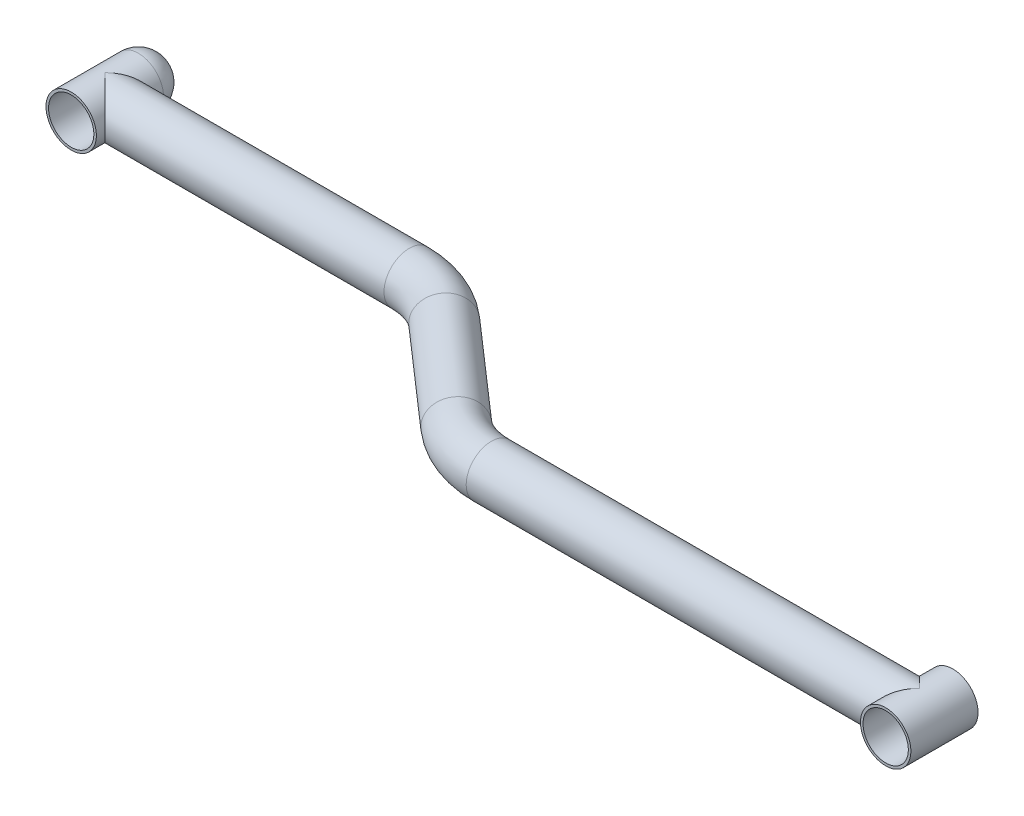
SolidWorks part; units mm, degrees
ref_plane "Plan de face" through (0, 0, 0) normal (0, 0, 1) x (1, 0, 0)
ref_plane "Plan de dessus" through (0, 0, 0) normal (0, 1, 0) x (1, 0, 0)
ref_plane "Plan de droite" through (0, 0, 0) normal (1, 0, 0) x (0, 0, -1)
sketch "Esquisse1" plane through (0, 0, 0) normal (0, 1, 0) x (1, 0, 0)
  line L0 (0, 0) -> (-509.594, 0)
  line L1 (-757.4787, 150) -> (-1120, 150)
  line L2 (-690.6009, 124.8881) -> (-576.4718, 25.1119)
  arc A0 (-757.4787, 150) -> (-690.6009, 124.8881) centre (-757.4787, 48.3898) cw
  arc A1 (-576.4718, 25.1119) -> (-509.594, 0) centre (-509.594, 101.6102) ccw
  dimension "D1" = 1120
  dimension "D2" = 150
sketch "Esquisse2" plane through (0, 0, 0) normal (1, 0, 0) x (0, 0, -1)
  circle A0 centre (0, 0) radius 30
  circle A1 centre (0, 0) radius 27
  dimension "D1" = 3
  dimension "D2" = 60
sweep "Balayage1" add profiles "Esquisse2" path "Esquisse1"
sketch "Esquisse3" plane through (0, 0, 0) normal (0, 1, 0) x (1, 0, 0)
  line L0 (0, -30) -> (0, 30) construction
  line L1 (0, 40) -> (30, 40)
  line L2 (0, 40) -> (0, -40)
  line L3 (0, -40) -> (30, -40)
  line L4 (30, 40) -> (30, -40)
  dimension "D1" = 30
  dimension "D2" = 80
revolve "Révolution1" add sketch "Esquisse3" angle 360 about L2
sketch "Esquisse4" plane through (0, 0, 0) normal (0, 1, 0) x (1, 0, 0)
  line L0 (-1120, 180) -> (-1120, 120) construction
  line L1 (-1120, 190) -> (-1150, 190)
  line L2 (-1120, 190) -> (-1120, 110)
  line L3 (-1120, 110) -> (-1150, 110)
  line L4 (-1150, 190) -> (-1150, 110)
  line L6 (-1120, 150) -> (-1676.3089, 150) construction
  line L7 (-1120, 177) -> (-1120, 123) construction
  dimension "D1" = 30
  dimension "D2" = 80
revolve "Révolution2" add sketch "Esquisse4" angle 360 about L2
sketch "Esquisse10" plane through (0, 0, 40) normal (0, 0, 1) x (1, 0, 0)
  circle A0 centre (0, 0) radius 27
  circle A1 centre (0, 0) radius 30 construction
  dimension "D1" = 3
extrude "Enlèv. mat.-Extru.1" cut sketch "Esquisse10" against normal through all
sketch "Esquisse11" plane through (0, 0, -110) normal (0, 0, 1) x (1, 0, 0)
  circle A0 centre (-1120, 0) radius 27
  circle A1 centre (-1120, 0) radius 30 construction
  dimension "D1" = 3
extrude "Enlèv. mat.-Extru.2" cut sketch "Esquisse11" against normal through all
sketch "Esquisse12" plane through (0, 0, 0) normal (0, 1, 0) x (1, 0, 0)
  line L0 (-1120, 190) -> (-1120, 231.718) construction
  line L1 (-1090, 190) -> (-1150, 190) construction
  line L2 (-1120, 110) -> (-1120, 190) construction
  line L3 (-1120, 190) -> (-1150, 190)
  line L4 (-1120, 220) -> (-1120, 190)
  arc A0 (-1150, 190) -> (-1120, 220) centre (-1120, 190) cw
revolve "Révolution3" add sketch "Esquisse12" angle 360 about L0
